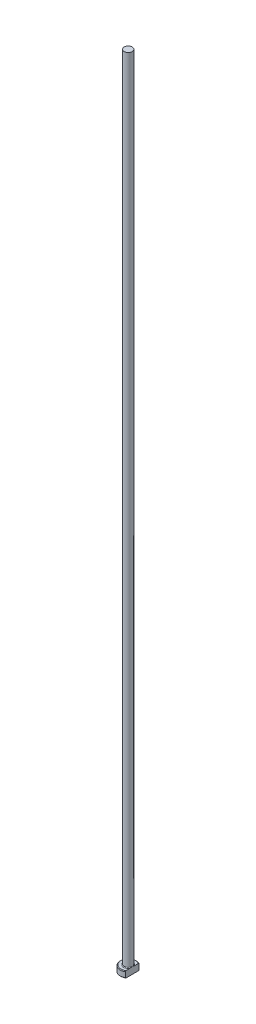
SolidWorks part; units mm, degrees
ref_plane "Front Plane" through (0, 0, 0) normal (0, 0, 1) x (1, 0, 0)
ref_plane "Top Plane" through (0, 0, 0) normal (0, 1, 0) x (1, 0, 0)
ref_plane "Right Plane" through (0, 0, 0) normal (1, 0, 0) x (0, 0, -1)
sketch "Sketch1" plane through (0, 0, 0) normal (0, 0, 1) x (1, 0, 0)
  line L0 (0, 259.9588) -> (0, -15.1925) construction
  line L1 (0, 0) -> (-2.5, 0)
  line L2 (-2.5, 0) -> (-2.5, 2)
  line L3 (-2.5, 2) -> (-1.25, 2)
  line L4 (-1.25, 2) -> (-1.25, 250)
  line L5 (-1.25, 250) -> (0, 250)
  line L6 (0, 250) -> (0, 0)
  dimension "L" = 250
  dimension "H" = 5
  dimension "T" = 2
  dimension "D" = 2.5
revolve "Revolve1" add sketch "Sketch1" angle 360 about L0
chamfer "Chamfer1" distance 0.2 angle 45 2 edges at (0, 2, 2.5) (0, 0, 2.5)
fillet "Fillet1" radius 0.2 1 edges at (0, 2, 1.25)
sketch "Sketch2" plane through (0, 0, 0) normal (0, 1, 0) x (1, 0, 0)
  line L0 (1.25, 2.1651) -> (1.25, -2.1651)
  circle A0 centre (0, 0) radius 2.5 construction
  arc A1 (1.25, -2.1651) -> (1.25, 2.1651) centre (0, 0) ccw
  circle A2 centre (0, 0) radius 1.25 construction
extrude "KEY" cut sketch "Sketch2" along normal through all
